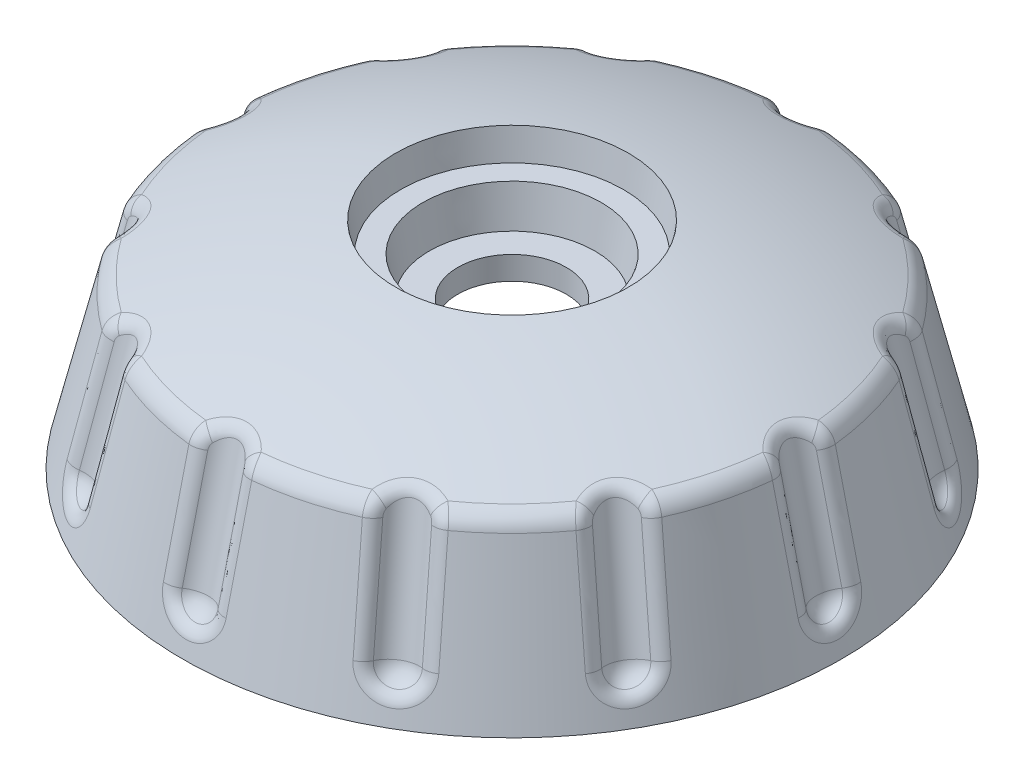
SolidWorks part; units mm, degrees
ref_plane "Front Plane" through (0, 0, 0) normal (0, 0, 1) x (1, 0, 0)
ref_plane "Top Plane" through (0, 0, 0) normal (0, 1, 0) x (1, 0, 0)
ref_plane "Right Plane" through (0, 0, 0) normal (1, 0, 0) x (0, 0, -1)
sketch "Sketch1" plane through (0, 0, 0) normal (0, 0, 1) x (1, 0, 0)
  line L0 (0, 0) -> (0, 36.4853) construction
  line L1 (-42.5, 0) -> (-37.5, 21)
  line L2 (-42.5, 0) -> (0, 0) construction
  line L3 (-15, 27.7675) -> (-14.3766, 24)
  line L4 (-14.3766, 24) -> (-11.5, 24)
  line L5 (-11.5, 24) -> (-10.6727, 19)
  line L6 (-10.6727, 19) -> (-7, 19)
  arc A0 (-37.5, 21) -> (-15, 27.7675) centre (0, -62.8906) cw
  dimension "D4" = 29
  dimension "D1" = 85
  dimension "D2" = 21
  dimension "D3" = 75
  dimension "D5" = 30
  dimension "D6" = 23
  dimension "D7" = 14
  dimension "D8" = 19
  dimension "D9" = 24
revolve "Revolve-Thin1" add sketch "Sketch1" angle 360 about L0
fillet "Fillet1" radius 3 1 edges at (0, 21, -37.5)
sketch "Sketch4" plane through (0, 0, 0) normal (0, 0, 1) x (1, 0, 0)
  line L0 (-37.8464, 19.5452) -> (-42.5, 0) construction
  line L1 (-36.2926, 30.3886) -> (-44.1143, -2.4628) construction
  line L2 (-39.1647, 5.3736) -> (-34.069, 26.7753)
  line L3 (-42.7779, 3.15) -> (-36.2926, 30.3886)
  line L4 (-42.7779, 3.15) -> (-60.6044, 7.3944) construction
  arc A0 (-42.7779, 3.15) -> (-39.1647, 5.3736) centre (-42.0831, 6.0685) ccw
  arc A1 (-36.2926, 30.3886) -> (-34.069, 26.7753) centre (-36.9874, 27.4702) cw
  dimension "D3" = 28
  dimension "D4" = 3
  dimension "D1" = 2
  dimension "D2" = 6
revolve "Cut-Revolve1" cut sketch "Sketch4" angle 360 about L1
fillet "Fillet2" radius 2 6 edges at (-41.7455, 3.1502, 0.608) (-39.1364, 13.7093, 2.7923) (-39.733, 11.2095, -2.7929) (-37.1656, 20.7367, 2.6605) (-36.8266, 21.1001, -2.5173) (-35.2286, 21.9783, -0.3185)
pattern_circular "CirPattern1" count 12 over 360 about axis through (0, 0, 0) along (0, -1, 0) of "Cut-Revolve1", "Fillet2"
